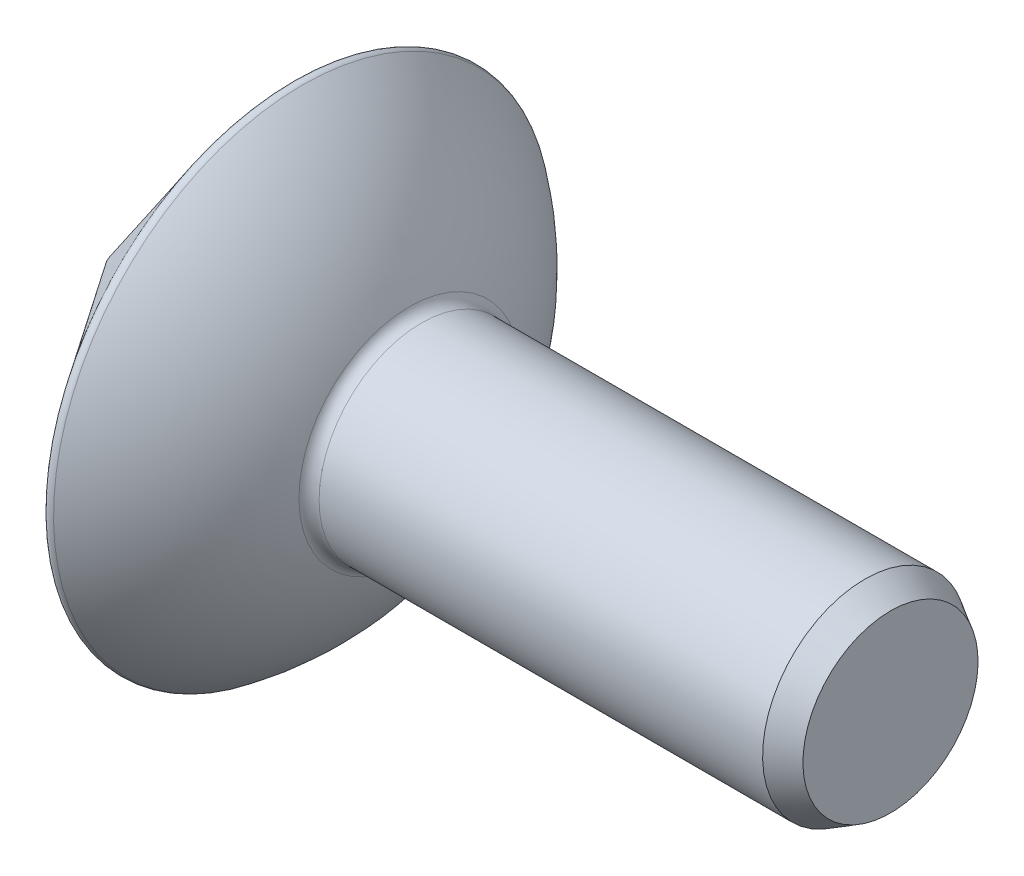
SolidWorks part; units mm, degrees
ref_plane "Plan de face" through (0, 0, 0) normal (0, 0, 1) x (1, 0, 0)
ref_plane "Plan de dessus" through (0, 0, 0) normal (0, 1, 0) x (1, 0, 0)
ref_plane "Plan de droite" through (0, 0, 0) normal (1, 0, 0) x (0, 0, -1)
sketch "Esquisse1" plane through (0, 0, 0) normal (0, 0, 1) x (1, 0, 0)
  line L0 (0, 0) -> (50.8631, 0) construction
  line L1 (-0.3993, 0.3009) -> (6.8162, 9.8762)
  line L2 (0, 0) -> (-14.9629, 0) construction
  line L3 (30, 4) -> (30, 0)
  line L4 (30, 0) -> (-0.5, 0)
  line L5 (30, 4) -> (11.3137, 4)
  arc A0 (-0.3993, 0.3009) -> (-0.5, 0) centre (0, 0) ccw
  arc A1 (11.3137, 4) -> (6.8162, 9.8762) centre (0, 0) ccw
  dimension "D1" = 0.5
  dimension "D5" = 12
  dimension "D6" = 30
  dimension "D2" = 53
  dimension "D4" = 8
  dimension "D7" = 19.7524
revolve "Révolution1" add sketch "Esquisse1" angle 360 about L2
fillet "Congé1" radius 0.25 1 edges at (6.8162, 9.8762, 0)
chamfer "Chanfrein1" distance 1 angle 30 1 edges at (30, 4, 0)
fillet "Congé2" radius 0.5 1 edges at (11.3137, 4, 0)
ref_plane "Plan1" through (-0.5, 0, 0) normal (1, 0, 0) x (0, 0, -1)
sketch "Esquisse2" plane through (0, 0, 0) normal (0, 0, 1) x (1, 0, 0)
  line L0 (30, 0) -> (-0.5, 0) construction
  line L1 (30, -3.4226) -> (30, 3.4226) construction
  dimension "D1" = 30.5
ref_point "Point1"
